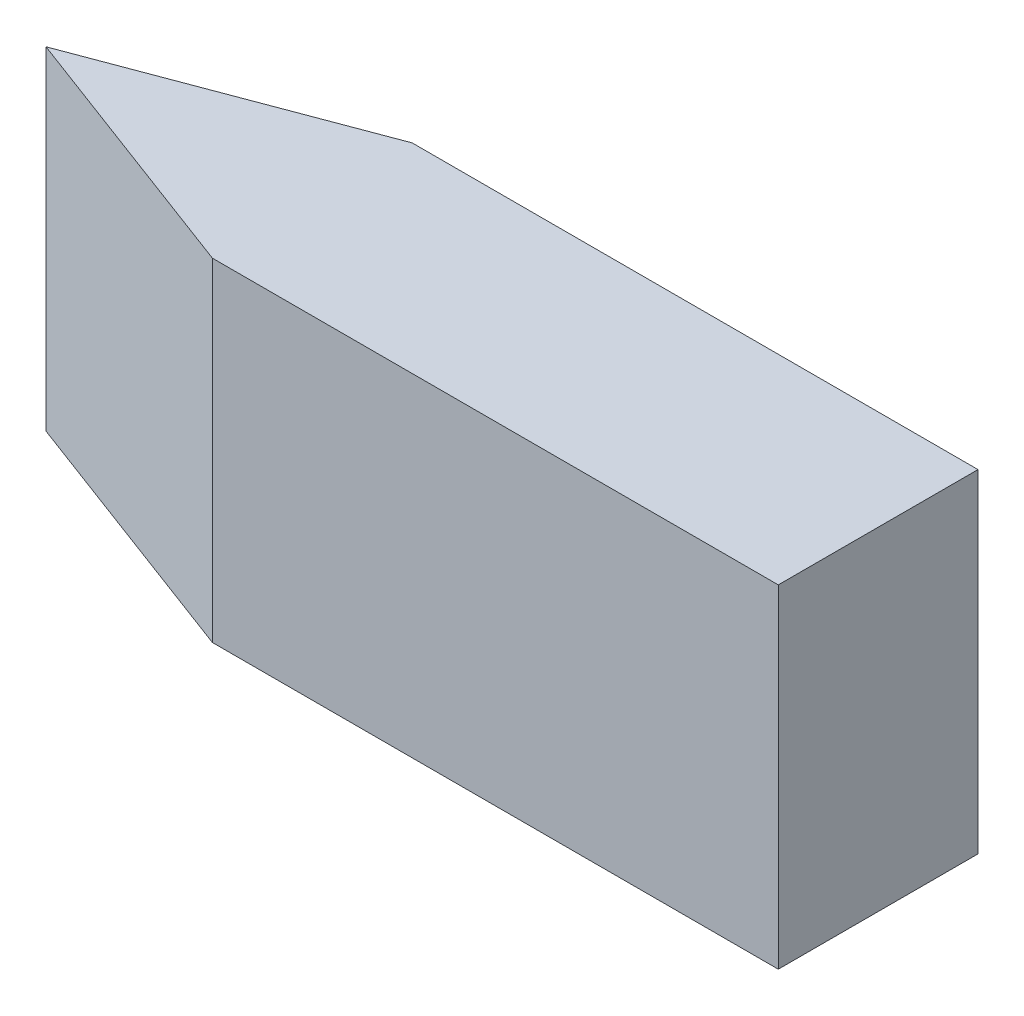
SolidWorks part; units mm, degrees
ref_plane "Front Plane" through (0, 0, 0) normal (0, 0, 1) x (1, 0, 0)
ref_plane "Top Plane" through (0, 0, 0) normal (0, 1, 0) x (1, 0, 0)
ref_plane "Right Plane" through (0, 0, 0) normal (1, 0, 0) x (0, 0, -1)
sketch "Sketch2" plane through (0, 0, 0) normal (0, 1, 0) x (1, 0, 0)
  line L0 (-17, 6) -> (-25, 3)
  line L1 (0, 0) -> (-17, 0)
  line L2 (0, 0) -> (0, 6)
  line L3 (0, 6) -> (-17, 6)
  line L5 (-25, 3) -> (-17, 0)
  dimension "D1" = 17
  dimension "D2" = 25
  dimension "D3" = 6
  dimension "D4" = 3
extrude "Extrude1" add sketch "Sketch2" along normal blind 10
